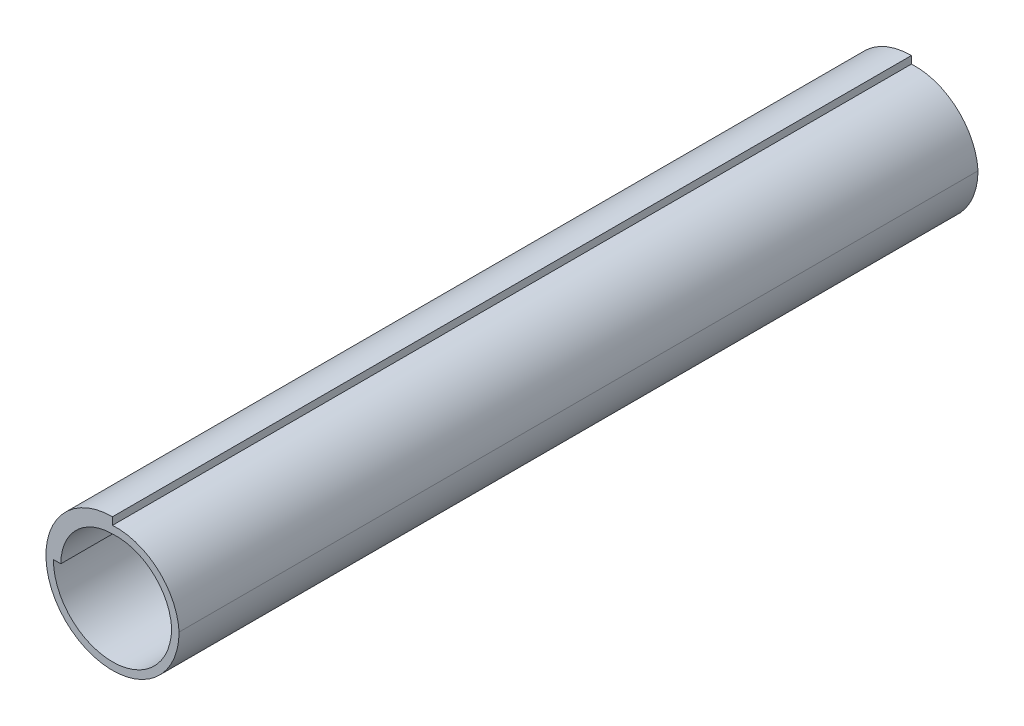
SolidWorks part; units mm, degrees
ref_plane "Plane1" through (0, 0, 0) normal (0, 0, 1) x (1, 0, 0)
ref_plane "Plane2" through (0, 0, 0) normal (0, 1, 0) x (1, 0, 0)
ref_plane "Plane3" through (0, 0, 0) normal (1, 0, 0) x (0, 0, -1)
sketch "Sketch1" plane through (0, 0, 0) normal (0, 0, 1) x (1, 0, 0)
  line L0 (0, 2.22) -> (0, 2.5)
  line L1 (-2.22, 0) -> (-1.94, 0)
  line L2 (0, 1.94) -> (2.22, 0) construction
  line L3 (0.14, -0.14) -> (1.11, 0.97) construction
  line L4 (0, 2.22) -> (2.5, 0) construction
  line L5 (0.14, -0.14) -> (1.25, 1.11) construction
  arc A0 (0, 2.5) -> (2.5, 0) centre (0, 0) ccw
  arc A1 (-2.22, 0) -> (2.22, 0) centre (0, 0) ccw
  arc A2 (0, 1.94) -> (-1.94, 0) centre (0, 0) ccw
  arc A3 (2.22, 0) -> (0, 1.94) centre (0.14, -0.14) ccw
  arc A4 (2.5, 0) -> (0, 2.22) centre (0.14, -0.14) ccw
  dimension "D1" = 0.28
  dimension "Diameter" = 5
  dimension "D2" = 4.44
  dimension "Thickness" = 0.28
extrude "Base-Extrude" add sketch "Sketch1" along normal mid plane 30
equation "\"D1@Sketch1\" = \"Thickness@Sketch1\""
equation "\"D2@Sketch1\" = \"Diameter@Sketch1\" - \"Thickness@Sketch1\" * 2"
